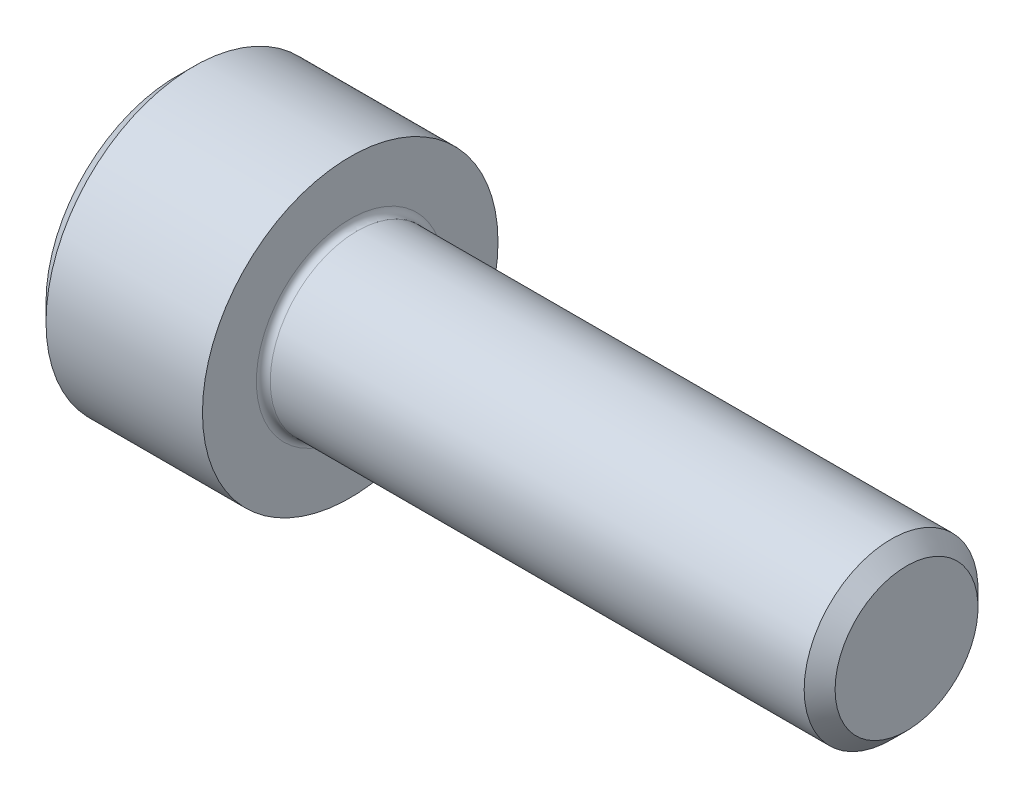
SolidWorks part; units mm, degrees
ref_plane "Plane1" through (0, 0, 0) normal (0, 0, 1) x (1, 0, 0)
ref_plane "Plane2" through (0, 0, 0) normal (0, 1, 0) x (1, 0, 0)
ref_plane "Plane3" through (0, 0, 0) normal (1, 0, 0) x (0, 0, -1)
revolve "Base-Revolve" add sketch "BodySke"
sketch "BodySke" plane through (0, 0, 0) normal (0, 0, 1) x (1, 0, 0)
  line L0 (0, 0) -> (0, 3.75)
  line L1 (0.5, 4.25) -> (5, 4.25)
  line L2 (5, 4.25) -> (5, 2.5)
  line L3 (5, 2.5) -> (20.555, 2.5)
  line L4 (21, 2.055) -> (21, 0)
  line L5 (21, 0) -> (0, 0)
  line L6 (-31.75, 0) -> (127, 0) construction
  line L7 (0, 3.75) -> (0.5, 4.25)
  line L8 (21, 2.055) -> (20.555, 2.5)
  line L9 (0, -3.75) -> (0.5, -4.25) construction
  line L10 (21, -2.055) -> (20.555, -2.5) construction
  line L11 (5.8, 9.525) -> (5.8, 3.175) construction
  line L12 (5, 9.525) -> (5, 3.175) construction
  line L13 (-29, 9.525) -> (-29, 3.175) construction
  dimension "Diameter" = 5
  dimension "Head_ht" = 5
  dimension "Length" = 16
  dimension "Body_ch_ang" = 45
  dimension "Head_dia" = 8.5
  dimension "Head_ch_ang" = 45
  dimension "Minor_dia" = 4.11
  dimension "Advance" = 0.8
  dimension "Thread_nom" = 16
  dimension "Thread_length" = 50
  dimension "Head_ch_ht" = 0.5
fillet "Fillet1" radius 0.2 1 edges at (5, 0, 2.5)
sketch "Sketch2" plane through (0, 0, 0) normal (0, 0, 1) x (1, 0, 0)
  line L0 (0, 2.042) -> (2.5, 2.042)
  line L1 (2.5, 2.042) -> (3.6789, 0)
  line L2 (-31.75, 0) -> (127, 0) construction
  line L3 (3.6789, 0) -> (0, 0)
  line L4 (0, 0) -> (0, 2.042)
  line L5 (0, 3.75) -> (0, -3.75) construction
  line L6 (0, 0) -> (47.625, 0) construction
  line L7 (5, -4.25) -> (5, 4.25) construction
  dimension "D1" = 2.042
  dimension "D2" = 60
  dimension "Wall_thickness" = 2.5
revolve "Hex-PreBroach" cut sketch "Sketch2" angle 360 about L6
sketch "Sketch3" plane through (0, 0, 0) normal (-1, 0, 0) x (0, 0.5, 0.866)
  line L0 (1.1789, 2.042) -> (-1.1789, 2.042)
  line L1 (-1.1789, 2.042) -> (-2.3579, 0)
  line L2 (1.1789, 2.042) -> (2.3579, 0)
  line L3 (1.1789, -2.042) -> (2.3579, 0)
  line L4 (1.1789, -2.042) -> (-1.1789, -2.042)
  line L5 (-1.1789, -2.042) -> (-2.3579, 0)
  dimension "D1" = 2.042
  dimension "D2" = 2.042
  dimension "Hex_size" = 4.084
extrude "Hex" cut sketch "Sketch3" against normal blind 2.5
sketch "Sketch4" plane through (0, 0, 0) normal (-1, 0, 0) x (0, 0, 1)
  line L0 (0, 0) -> (2.3876, 0)
  line L1 (0, 0) -> (6.1484, 3.5498) construction
  line L2 (0, 0) -> (1.1938, 2.0677)
  line L3 (1.9883, 0.576) -> (2.2704, 0.7389)
  line L4 (1.493, 1.4339) -> (1.7751, 1.5968)
  arc A0 (1.9883, 0.576) -> (1.493, 1.4339) centre (0, 0) ccw
  arc A1 (2.3876, 0) -> (2.2704, 0.7389) centre (0, 0) ccw
  arc A2 (1.1938, 2.0677) -> (1.7751, 1.5968) centre (0, 0) cw
  dimension "D1" = 30
  dimension "Spline_n_dim" = 4.1402
  dimension "Spline_m_dim" = 4.7752
  dimension "D2" = 60
  dimension "D3" = 0.4953
  dimension "Spline_p_dim" = 0.9906
extrude "Spline" cut sketch "Sketch4" against normal blind 2.5
pattern_circular "CirPattern1" count 6 every 60
sketch "Sketch5" plane through (0, 0, 0) normal (0, 0, 1) x (1, 0, 0)
  line L0 (-31.75, 0) -> (127, 0) construction
  line L2 (0, 3.75) -> (0, -3.75) construction
  circle A0 centre (2, 0) radius 0.675
  dimension "Drilled_hole_dia" = 1.35
  dimension "Drilled_hole_loc" = 2
extrude "Hole" cut sketch "Sketch5" against normal through all and the other way through all
pattern_circular "Drilled-4" count 2 every 60
pattern_circular "Drilled-6" count 3 every 60
sketch "ThdSchSke" plane through (0, 0, 0) normal (0, 0, 1) x (1, 0, 0)
  line L0 (5.8, -2.055) -> (5.4884, -2.5)
  line L1 (5.8, -2.055) -> (6.1116, -2.5)
  line L2 (6.1116, -2.5) -> (6.1116, -3.125)
  line L3 (-3.175, 0) -> (5.1513, 0) construction
  line L5 (6.1116, -3.125) -> (5.4884, -3.125)
  line L6 (5.4884, -3.125) -> (5.4884, -2.5)
  line L7 (0, 3.75) -> (0, -3.75) construction
  dimension "Thread_minor" = 4.11
  dimension "Diameter" = 5
  dimension "Start" = 5.8
  dimension "SideAngle" = 55
  dimension "VeeAngle" = 70
  dimension "Overcut" = 6.25
revolve "ThreadSchematic" cut sketch "ThdSchSke" angle 360 about L3
pattern_linear "ThdSchPat"
equation "\"D2@Sketch3\" = \"Hex_size@Sketch3\" / 2"
equation "\"D1@Sketch3\" = \"Hex_size@Sketch3\" / 2"
equation "\"D1@Sketch2\" = \"Hex_size@Sketch3\" / 2"
equation "\"D3@Sketch4\" = \"Spline_p_dim@Sketch4\" / 2"
equation "\"Thread_minor@ThreadCosmetic\"  =  \"Minor_dia@BodySke\""
equation "\"D2@CirPattern1\" = 360 / \"Num_teeth@CirPattern1\""
equation "\"Wall_thickness@Sketch2\" = \"Head_ht@BodySke\" - \"Key_eng@Hex\""
equation "\"Thread_length@ThreadCosmetic\" = ((sgn( (\"Length@BodySke\" - \"Advance@BodySke\" ) - \"Thread_nom@BodySke\" )-1)*( (\"Length@BodySke\" - \"Advance@BodySke\" ) - \"Thread_nom@BodySke\" ))/-2+ \"Thread_nom@BodySke\""
equation "\"Thread_minor@ThdSchSke\" = \"Minor_dia@BodySke\""
equation "\"Diameter@ThdSchSke\" = \"Diameter@BodySke\""
equation "\"Overcut@ThdSchSke\" = \"Diameter@BodySke\" * 1.25"
equation "\"Start@ThdSchSke\" = \"Head_ht@BodySke\" + \"Length@BodySke\" - \"Thread_length@ThreadCosmetic\"  '---Non-countersunk---"
equation "\"Num_threads@ThdSchPat\" = int( \"Thread_length@ThreadCosmetic\" / \"Advance@BodySke\" + 0.999 )  + 1"
equation "\"Advance@ThdSchPat\" = \"Thread_length@ThreadCosmetic\" /  (\"Num_threads@ThdSchPat\" - 1) 'relax it"
equation "\"Num_threads@ThdSchPat\" = \"Num_threads@ThdSchPat\" - sgn( \"Num_threads@ThdSchPat\" - 1) '---chamfered tips only---"
